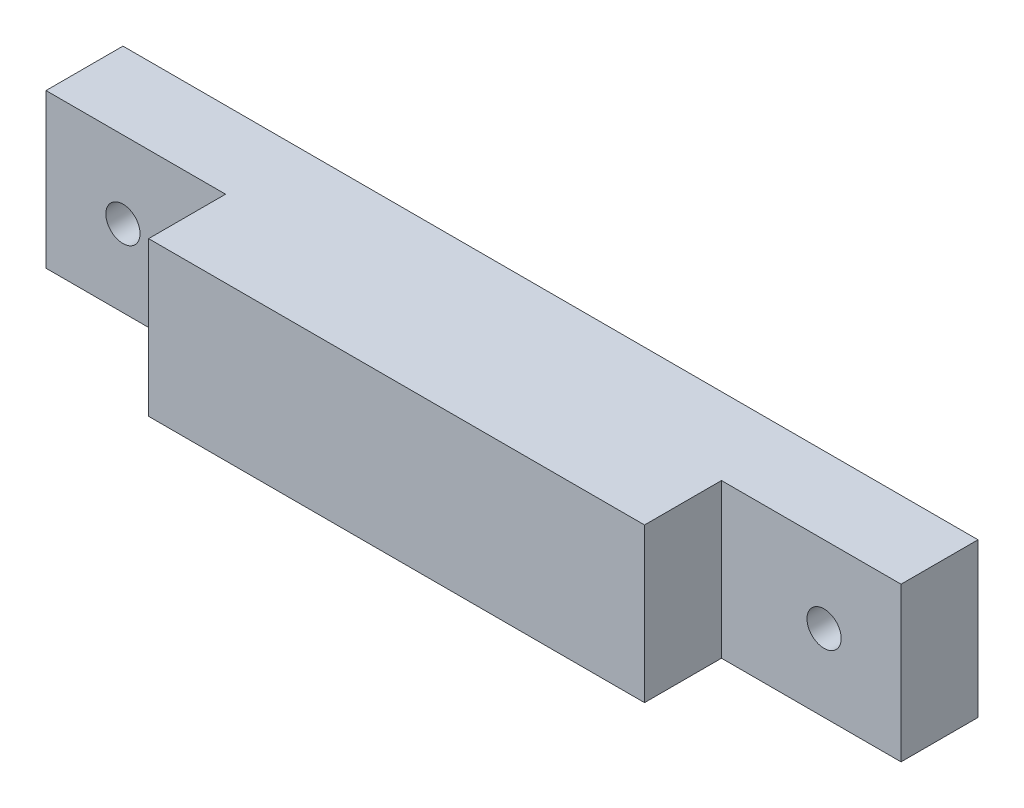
SolidWorks part; units mm, degrees
ref_plane "Plan de face" through (0, 0, 0) normal (0, 0, 1) x (1, 0, 0)
ref_plane "Plan de dessus" through (0, 0, 0) normal (0, 1, 0) x (1, 0, 0)
ref_plane "Plan de droite" through (0, 0, 0) normal (1, 0, 0) x (0, 0, -1)
sketch "Esquisse1" plane through (0, 0, 0) normal (0, 0, 1) x (1, 0, 0)
  line L1 (0, 0) -> (50, 0)
  line L2 (0, 0) -> (0, 9)
  line L3 (0, 9) -> (50, 9)
  line L4 (50, 0) -> (50, 9)
  dimension "D1" = 50
  dimension "D2" = 9
extrude "Extrusion1" add sketch "Esquisse1" along normal blind 9
sketch "Esquisse2" plane through (0, 0, 9) normal (0, 0, 1) x (1, 0, 0)
  line L0 (50, 9) -> (0, 9) construction
  line L1 (0, 0) -> (10.5, 0)
  line L2 (0, 0) -> (0, 9)
  line L3 (0, 9) -> (10.5, 9)
  line L4 (10.5, 0) -> (10.5, 9)
  line L6 (50, 0) -> (39.5, 0)
  line L7 (50, 0) -> (50, 9)
  line L8 (50, 9) -> (39.5, 9)
  line L9 (39.5, 0) -> (39.5, 9)
  dimension "D1" = 10.5
  dimension "D2" = 10.5
extrude "Enlèv. mat.-Extru.1" cut sketch "Esquisse2" against normal blind 4.5 and the other way blind 1
sketch "Esquisse3" plane through (0, 0, 4.5) normal (0, 0, 1) x (1, 0, 0)
  line L0 (50, 0) -> (50, 9) construction
  line L1 (0, 9) -> (0, 0) construction
  line L2 (0, 0) -> (10.5, 0) construction
  line L3 (39.5, 0) -> (50, 0) construction
  circle A0 centre (45.5, 4.5) radius 1
  circle A1 centre (4.5, 4.5) radius 1
  point P4 (50, 4.5)
  point P7 (0, 4.5)
  dimension "D5" = 2
  dimension "D6" = 2
  dimension "D1" = 4.5
  dimension "D2" = 4.5
  dimension "D3" = 4.5
  dimension "D4" = 4.5
extrude "Enlèv. mat.-Extru.2" cut sketch "Esquisse3" against normal blind 4.5
